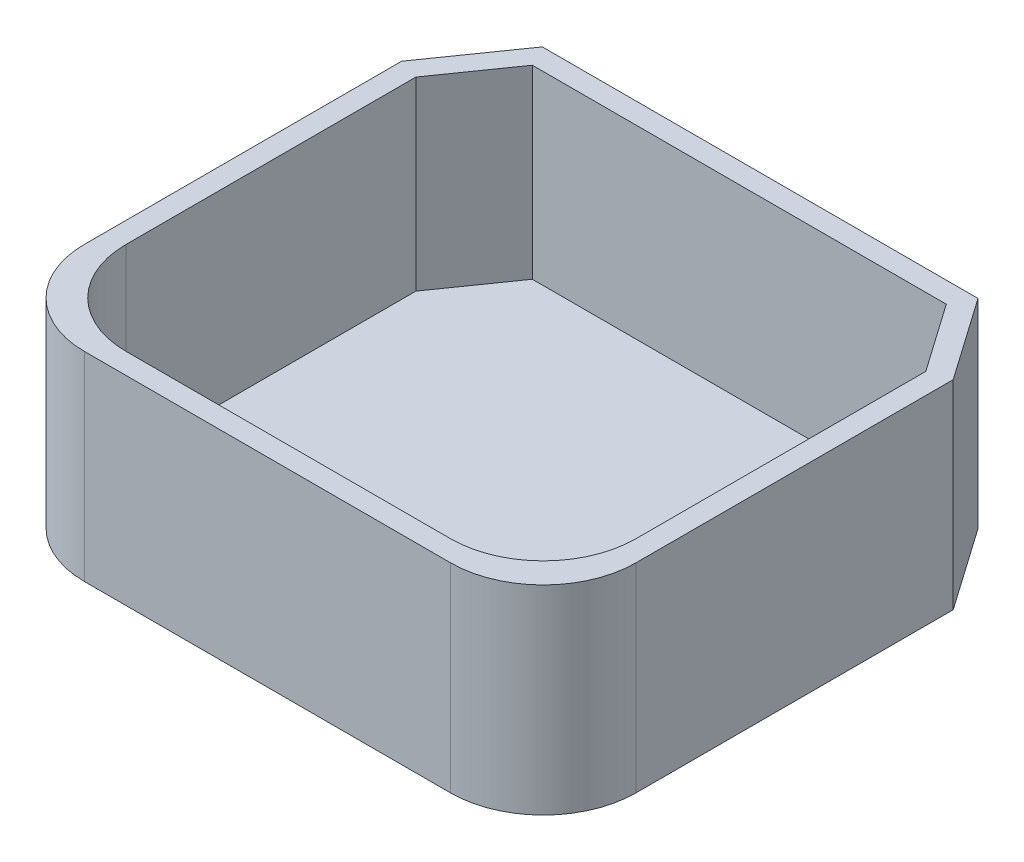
SolidWorks part; units mm, degrees
ref_plane "前视基准面" through (0, 0, 0) normal (0, 0, 1) x (1, 0, 0)
ref_plane "上视基准面" through (0, 0, 0) normal (0, 1, 0) x (1, 0, 0)
ref_plane "右视基准面" through (0, 0, 0) normal (1, 0, 0) x (0, 0, -1)
other "Configuration Table"
sketch "草图1" plane through (0, 0, 0) normal (0, 1, 0) x (1, 0, 0)
  line L0 (4.7, 5.315) -> (5.95, 3.5298)
  line L1 (-5.95, -5.315) -> (5.95, -5.315)
  line L2 (-5.95, -5.315) -> (-5.95, 5.315) construction
  line L3 (-5.95, 5.315) -> (5.95, 5.315) construction
  line L4 (5.95, -5.315) -> (5.95, 5.315) construction
  line L5 (-5.95, -5.315) -> (5.95, 5.315) construction
  line L6 (-5.95, 5.315) -> (5.95, -5.315) construction
  line L7 (-4.7, 5.315) -> (-5.95, 3.5298)
  line L8 (4.7, 5.315) -> (-4.7, 5.315)
  line L9 (5.95, 3.5298) -> (5.95, -5.315)
  line L10 (-5.95, 3.5298) -> (-5.95, -5.315)
  point P0 (0, 0)
  point P10 (0, 5.315)
  dimension "D1" = 11.9
  dimension "D2" = 10.63
  dimension "D3" = 9.4
  dimension "D4" = 125
  dimension "D5" = 125
extrude "凸台-拉伸1" add sketch "草图1" along normal blind 0.3
sketch "草图2" plane through (0, 0.3, 0) normal (0, 1, 0) x (1, 0, 0)
  line L0 (-4.7, 5.315) -> (-5.95, 3.5298)
  line L1 (-5.95, 3.5298) -> (-5.95, -5.315)
  line L2 (-5.95, -5.315) -> (5.95, -5.315)
  line L3 (5.95, -5.315) -> (5.95, 3.5298)
  line L4 (5.95, 3.5298) -> (4.7, 5.315)
  line L5 (4.7, 5.315) -> (-4.7, 5.315)
  line L6 (-4.4657, 4.865) -> (-5.5, 3.3879)
  line L7 (-5.5, 3.3879) -> (-5.5, -4.865)
  line L8 (-5.5, -4.865) -> (5.5, -4.865)
  line L9 (5.5, -4.865) -> (5.5, 3.3879)
  line L10 (5.5, 3.3879) -> (4.4657, 4.865)
  line L11 (4.4657, 4.865) -> (-4.4657, 4.865)
  dimension "D1" = 0.45
extrude "凸台-拉伸2" add sketch "草图2" along normal blind 4
sketch "草图3" plane through (0, 4.3, 0) normal (0, 1, 0) x (1, 0, 0)
  line L0 (-4.7, 5.315) -> (-5.95, 3.5298)
  line L1 (-5.95, 3.5298) -> (-5.95, -5.315)
  line L2 (-5.95, -5.315) -> (5.95, -5.315)
  line L3 (5.95, -5.315) -> (5.95, 3.5298)
  line L4 (5.95, 3.5298) -> (4.7, 5.315) construction
  line L5 (5.95, 3.5298) -> (4.7, 5.315)
  line L6 (4.7, 5.315) -> (-4.7, 5.315)
extrude "凸台-拉伸3" [suppressed] add sketch "草图3" along normal blind 0.3
fillet "圆角2" radius 2 4 edges at (5.5, 2.3, 4.865) (-5.5, 2.3, 4.865) (-5.95, 2.15, 5.315) (5.95, 2.15, 5.315)
sketch "草图4" plane through (0, 0.3, 0) normal (0, 1, 0) x (1, 0, 0)
  line L0 (-4.7, -4.865) -> (-4.4, -4.865)
  line L1 (-3.5, -4.865) -> (3.5, -4.865) construction
  line L2 (-4.4, -4.865) -> (-4.4, -3.265)
  line L3 (-4.4, -3.265) -> (-4.7, -3.265)
  line L4 (-4.7, -3.265) -> (-4.7, -4.865)
  line L5 (4.4, -4.865) -> (4.7, -4.865)
  line L6 (4.7, -4.865) -> (4.7, -3.265)
  line L7 (4.7, -3.265) -> (4.4, -3.265)
  line L8 (4.4, -3.265) -> (4.4, -4.865)
  line L9 (-4.4, -3.265) -> (4.4, -3.265) construction
  line L10 (-4.4657, 4.865) -> (4.4657, 4.865) construction
  point P14 (0, -3.265)
  point P15 (0, 4.865)
  dimension "D1" = 0.3
  dimension "D2" = 8.8
  dimension "D3" = 0.3
  dimension "D4" = 1.6
extrude "凸台-拉伸4" add sketch "草图4" along normal blind 2
